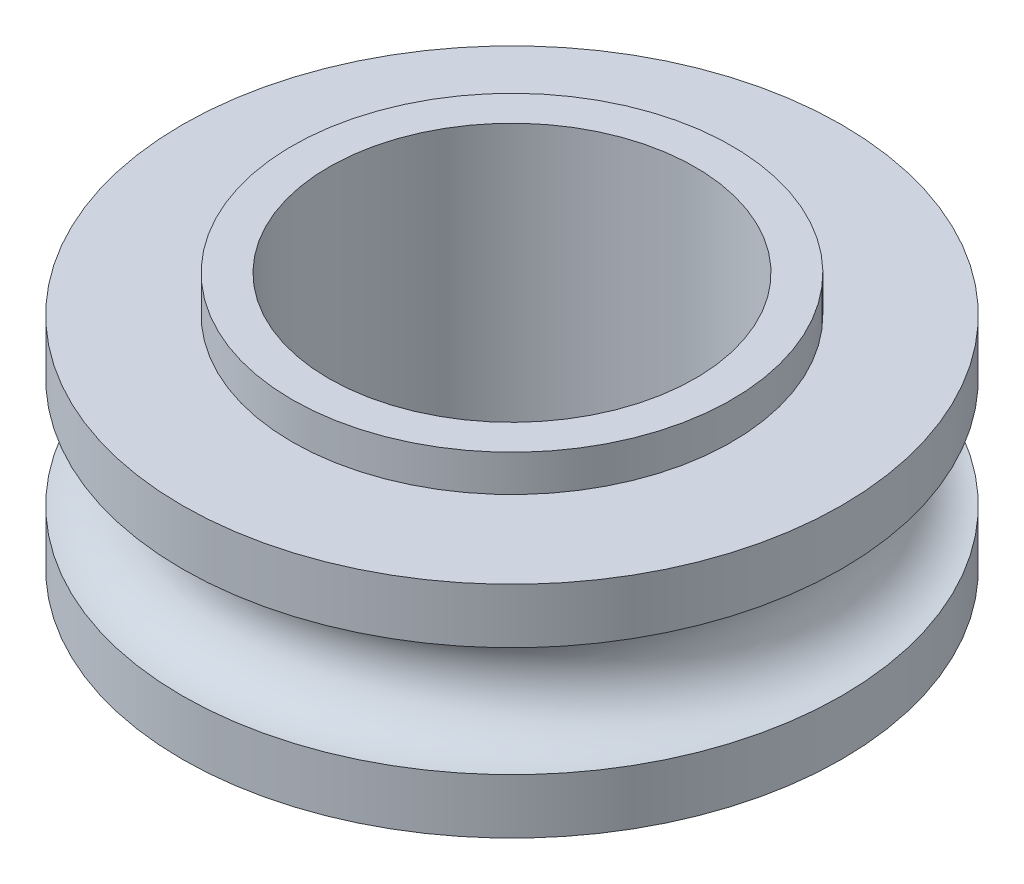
SolidWorks part; units mm, degrees
ref_plane "Front Plane" through (0, 0, 0) normal (0, 0, 1) x (1, 0, 0)
ref_plane "Top Plane" through (0, 0, 0) normal (0, 1, 0) x (1, 0, 0)
ref_plane "Right Plane" through (0, 0, 0) normal (1, 0, 0) x (0, 0, -1)
sketch "Sketch1" plane through (0, 0, 0) normal (0, 0, 1) x (1, 0, 0)
  line L0 (0, 26.6473) -> (0, -26.6473) construction
  line L1 (28.575, -4.7625) -> (28.575, -9.525)
  line L2 (19.05, 9.525) -> (28.575, 9.525)
  line L3 (15.875, 9.525) -> (15.875, -9.525)
  line L4 (19.05, -9.525) -> (28.575, -9.525)
  line L5 (28.575, 9.525) -> (28.575, 4.7625)
  line L8 (15.875, 9.525) -> (15.875, 12.7)
  line L9 (15.875, 12.7) -> (19.05, 12.7)
  line L10 (19.05, 9.525) -> (19.05, 12.7)
  line L12 (15.875, -9.525) -> (15.875, -12.7)
  line L13 (15.875, -12.7) -> (19.05, -12.7)
  line L14 (19.05, -9.525) -> (19.05, -12.7)
  arc A0 (28.575, 4.7625) -> (28.575, -4.7625) centre (28.575, 0) ccw
  point P9 (15.875, 0)
  dimension "D4" = 4.7625
  dimension "D1" = 31.75
  dimension "D2" = 12.7
  dimension "D3" = 19.05
  dimension "D5" = 3.175
  dimension "D6" = 25.4
  dimension "D7" = 19.05
  dimension "D8" = 9.525
revolve "Revolve1" add sketch "Sketch1" angle 360 about L0
